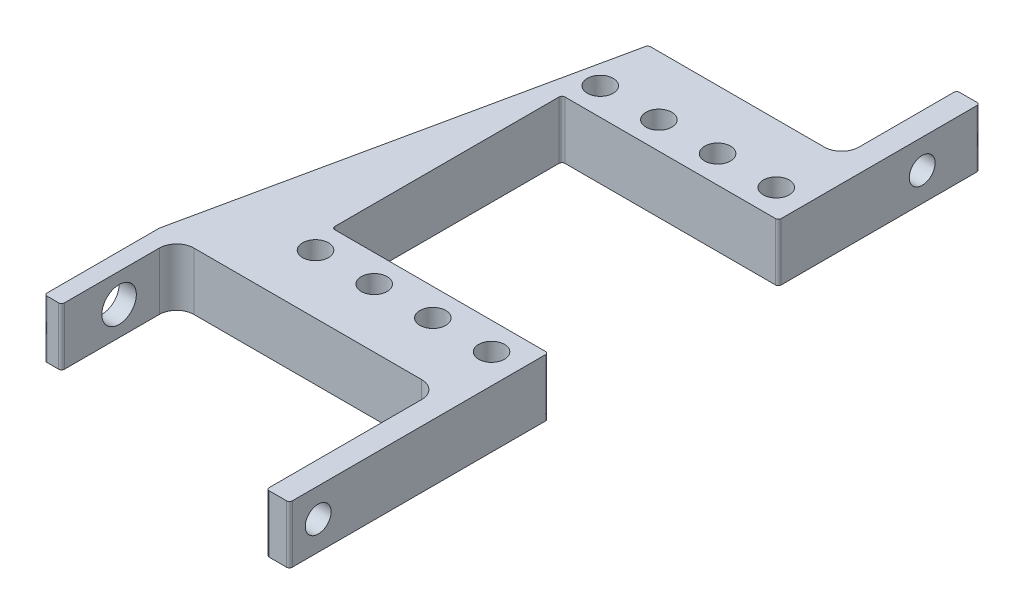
SolidWorks part; units mm, degrees
ref_plane "Front Plane" through (0, 0, 0) normal (0, 0, 1) x (1, 0, 0)
ref_plane "Top Plane" through (0, 0, 0) normal (0, 1, 0) x (1, 0, 0)
ref_plane "Right Plane" through (0, 0, 0) normal (1, 0, 0) x (0, 0, -1)
sketch "Sketch2" plane through (0, 0, 0) normal (0, 1, 0) x (1, 0, 0)
  line L0 (0, 0) -> (0, 20)
  line L1 (0, 20) -> (14.9944, 90.0021)
  line L2 (0, 0) -> (15, 0)
  line L3 (15, 0) -> (15, 20)
  line L4 (15, 20) -> (52.6144, 20)
  line L5 (52.6144, 20) -> (52.6144, 35)
  line L6 (52.6144, 90.0021) -> (14.9944, 90.0021)
  line L8 (15, 35) -> (52.6144, 35)
  line L9 (15, 35) -> (15, 75)
  line L10 (15, 75) -> (52.6144, 75)
  line L14 (52.6144, 75) -> (52.6144, 90.0021)
  dimension "D1" = 20
  dimension "D2" = 71.59
  dimension "D3" = 167.91
  dimension "D4" = 15
  dimension "D5" = 40
  dimension "D6" = 15
  dimension "D7" = 37.62
extrude "Boss-Extrude1" add sketch "Sketch2" along normal blind 10 contours L3 L4 L5 L8 L9 L10 L14 L6 L1 L0 L2
sketch "Sketch4" plane through (0, 10, 0) normal (0, 1, 0) x (1, 0, 0)
  line L0 (15, 35) -> (52.6144, 35) construction
  line L1 (15, 35) -> (15, 75) construction
  circle A0 centre (16.9, 30.25) radius 2.25
  dimension "D1" = 4.5
  dimension "D2" = 4.75
  dimension "D3" = 1.9
extrude "Cut-Extrude2" cut sketch "Sketch4" against normal blind 26
pattern_linear "LPattern2" count 22 spacing 10.2 along (1, 0, 0) of "Cut-Extrude2"
sketch "Sketch5" plane through (0, 0, -20) normal (0, 0, 1) x (1, 0, 0)
  line L0 (55, 0) -> (-55, 0) construction
  line L1 (52.6144, 10) -> (40.6144, 10)
  line L2 (52.6144, 10) -> (52.6144, 0)
  line L3 (52.6144, 0) -> (40.6144, 0)
  line L4 (40.6144, 10) -> (40.6144, 0)
  dimension "D1" = 12
extrude "Boss-Extrude2" add sketch "Sketch5" along normal blind 30
sketch "Sketch6" plane through (0, 0, -90.0021) normal (0, 0, -1) x (-1, 0, 0)
  line L0 (55, 0) -> (-55, 0) construction
  line L1 (-52.6144, 10) -> (-40.6144, 10)
  line L2 (-52.6144, 10) -> (-52.6144, 0)
  line L3 (-52.6144, 0) -> (-40.6144, 0)
  line L4 (-40.6144, 10) -> (-40.6144, 0)
  dimension "D1" = 12
extrude "Boss-Extrude3" add sketch "Sketch6" along normal blind 20
sketch "Sketch7" plane through (40.6144, 0, 0) normal (-1, 0, 0) x (0, 0, 1)
  line L0 (-110.0021, 10) -> (-90.0021, 0) construction
  line L1 (55, 0) -> (-55, 0) construction
  line L2 (-90.0021, 0) -> (-90.0021, 10) construction
  line L3 (-90.0021, 10) -> (-110.0021, 0) construction
  circle A0 centre (-100.0021, 5) radius 2.25
  dimension "D1" = 4.5
extrude "Cut-Extrude3" cut sketch "Sketch7" against normal blind 20 contours A0
sketch "Sketch10" plane through (40.6144, 0, 0) normal (-1, 0, 0) x (0, 0, 1)
  line L0 (10, 10) -> (0, 10) construction
  line L1 (10, 10) -> (-20, 10) construction
  line L4 (0, 10) -> (10, 0) construction
  line L5 (55, 0) -> (-55, 0) construction
  line L6 (10, 10) -> (0, 0) construction
  circle A1 centre (5, 5) radius 2.25
  dimension "D1" = 10
  dimension "D2" = 4.5
extrude "Cut-Extrude4" cut sketch "Sketch10" against normal blind 20
ref_plane "Plane1" through (0, 0, -55) normal (0, 0, 1) x (1, 0, 0)
mirror "Mirror1" about plane through (0, 0, -55) normal (0, 0, 1) of "LPattern2", "Cut-Extrude2"
sketch "Sketch11" plane through (15, 0, 0) normal (1, 0, 0) x (0, 0, -1)
  line L4 (0, 0) -> (20, 0)
  line L5 (20, 0) -> (20, 10)
  line L6 (20, 10) -> (0, 10)
  line L7 (0, 10) -> (0, 0)
  line L8 (0, 0) -> (20, 0)
  line L9 (20, 0) -> (20, 10)
  line L10 (20, 10) -> (0, 10)
  line L11 (0, 10) -> (0, 0)
  dimension "D1" = 0
extrude "Cut-Extrude5" cut sketch "Sketch11" against normal blind 12
sketch "Sketch12" plane through (3, 0, 0) normal (1, 0, 0) x (0, 0, -1)
  line L0 (0, 10) -> (20, 0) construction
  line L1 (20, 10) -> (0, 0) construction
  circle A0 centre (10, 5) radius 3
  dimension "D1" = 6
extrude "Cut-Extrude6" cut sketch "Sketch12" against normal blind 12
sketch "Sketch13" plane through (40.6144, 0, 0) normal (-1, 0, 0) x (0, 0, 1)
  line L4 (-90.0021, 0) -> (-90.0021, 10)
  line L5 (-90.0021, 10) -> (-110.0021, 10)
  line L6 (-110.0021, 10) -> (-110.0021, 0)
  line L7 (-110.0021, 0) -> (-90.0021, 0)
  line L8 (-90.0021, 0) -> (-90.0021, 10)
  line L9 (-90.0021, 10) -> (-110.0021, 10)
  line L10 (-110.0021, 10) -> (-110.0021, 0)
  line L11 (-110.0021, 0) -> (-90.0021, 0)
  dimension "D1" = 0
extrude "Cut-Extrude7" cut sketch "Sketch13" against normal blind 8
sketch "Sketch14" plane through (40.6144, 0, 0) normal (-1, 0, 0) x (0, 0, 1)
  line L4 (-20, 10) -> (-20, 0)
  line L5 (-20, 0) -> (10, 0)
  line L6 (10, 0) -> (10, 10)
  line L7 (10, 10) -> (-20, 10)
  line L8 (-20, 10) -> (-20, 0)
  line L9 (-20, 0) -> (10, 0)
  line L10 (10, 0) -> (10, 10)
  line L11 (10, 10) -> (-20, 10)
  dimension "D1" = 0
extrude "Cut-Extrude8" cut sketch "Sketch14" against normal blind 8
fillet "Fillet1" radius 3 3 edges at (48.6144, 5, -20) (3, 5, -20) (48.6144, 5, -90.0021)
fillet "Fillet2" radius 0.5 11 edges at (14.9944, 5, -90.0021) (48.6144, 5, -110.0021) (52.6144, 5, -110.0021) (52.6144, 5, -75) (15, 5, -75) (15, 5, -35) (52.6144, 5, -35) (52.6144, 5, 10) (48.6144, 5, 10) (0, 5, 0) (3, 5, 0)
